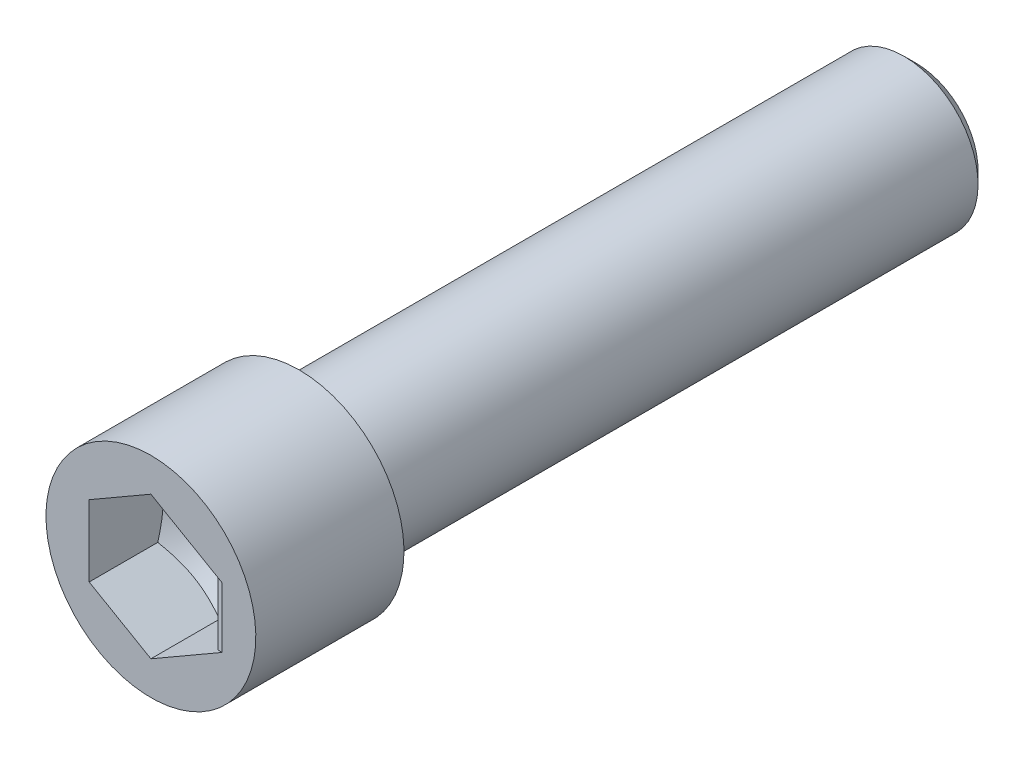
SolidWorks part; units mm, degrees
ref_plane "Front Plane" through (0, 0, 0) normal (0, 0, 1) x (1, 0, 0)
ref_plane "Top Plane" through (0, 0, 0) normal (0, 1, 0) x (1, 0, 0)
ref_plane "Right Plane" through (0, 0, 0) normal (1, 0, 0) x (0, 0, -1)
imported_body "Imported3"
sketch "Sketch1" plane through (0, 0, 0) normal (0, 0, -1) x (-1, 0, 0)
  circle A0 centre (0, 0) radius 3
extrude "Boss-Extrude1" add sketch "Sketch1" along normal blind 25
chamfer "Chamfer1" distance 0.5 angle 45 1 edges at (0, 3, -25)
chamfer "Chamfer2" distance 0.2233 angle 60 1 edges at (2.5, 0, 6)
